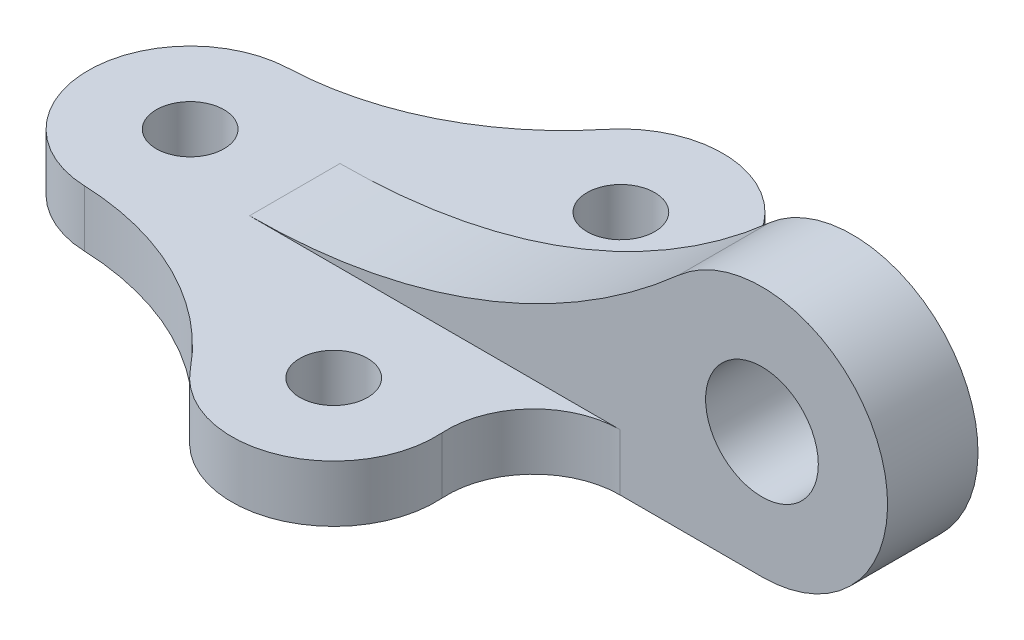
SolidWorks part; units mm, degrees
ref_plane "Front Plane" through (0, 0, 0) normal (0, 0, 1) x (1, 0, 0)
ref_plane "Top Plane" through (0, 0, 0) normal (0, 1, 0) x (1, 0, 0)
ref_plane "Right Plane" through (0, 0, 0) normal (1, 0, 0) x (0, 0, -1)
sketch "Sketch1" plane through (0, 0, 0) normal (0, 1, 0) x (1, 0, 0)
  line L0 (84.0039, 8.001) -> (84.0039, -8.001)
  line L1 (84.0039, 8.001) -> (105.7834, 8.001) construction
  arc A0 (-0.6921, 18.0207) -> (-0.6921, -18.0207) centre (0, 0) ccw
  arc A1 (68.796, 24.2299) -> (36.7987, 36.7661) centre (50.8, 25.4) ccw
  arc A2 (36.7987, -36.7661) -> (68.796, -24.2299) centre (50.8, -25.4) ccw
  arc A3 (-0.6921, 18.0207) -> (36.7987, 36.7661) centre (-2.6416, 68.7833) ccw
  arc A4 (-0.6921, -18.0207) -> (36.7987, -36.7661) centre (-2.6416, -68.7833) cw
  arc A5 (68.796, -24.2299) -> (84.0039, -8.001) centre (84.0039, -23.241) cw
  arc A6 (68.796, 24.2299) -> (84.0039, 8.001) centre (84.0039, 23.241) ccw
  circle A7 centre (50.8, 25.4) radius 5.9944
  circle A8 centre (0, 0) radius 5.9944
  circle A9 centre (50.8, -25.4) radius 5.9944
  dimension "D1" = 11.9888
  dimension "D2" = 18.034
  dimension "D3" = 50.8
  dimension "D4" = 15.24
  dimension "D5" = 50.8
  dimension "D6" = 25.4
  dimension "D7" = 50.8
  dimension "D8" = 16.002
  dimension "D9" = 8.001
extrude "Extrude1" add sketch "Sketch1" along normal blind 10.0076
sketch "Sketch2" plane through (0, 0, 0) normal (0, 0, 1) x (1, 0, 0)
  line L0 (36.7987, 10.0076) -> (-0.6921, 10.0076) construction
  line L1 (109.1629, 0) -> (18.5085, 0)
  line L2 (-0.6921, 0) -> (36.7987, 0) construction
  line L3 (18.5085, 0) -> (18.5085, 10.0076)
  arc A0 (18.5085, 10.0076) -> (94.4052, 38.8431) centre (18.5085, 124.3076) ccw
  arc A1 (94.4052, 38.8431) -> (109.1629, 0) centre (109.1629, 22.225) cw
  circle A2 centre (109.1629, 22.225) radius 9.9695
  dimension "D1" = 19.939
  dimension "D2" = 22.225
  dimension "D3" = 114.3
  dimension "D4" = 109.855
extrude "Extrude2" add sketch "Sketch2" along normal mid plane 16.002
